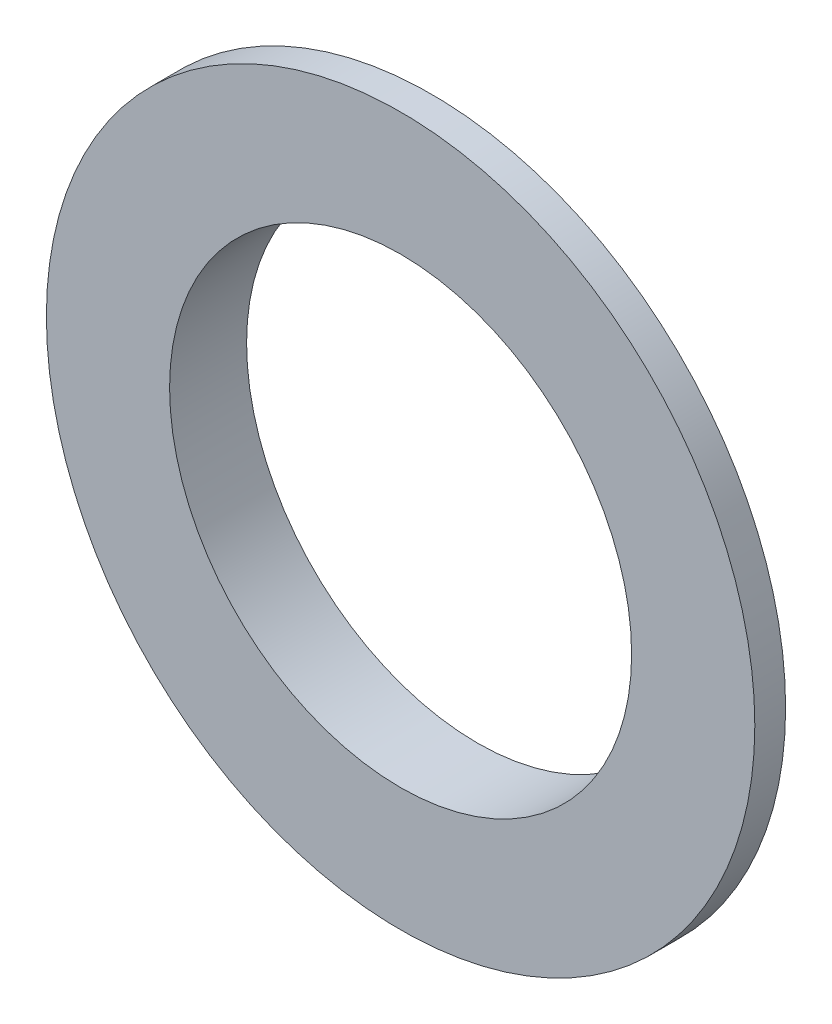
SolidWorks part; units mm, degrees
ref_plane "Plan de face" through (0, 0, 0) normal (0, 0, 1) x (1, 0, 0)
ref_plane "Plan de dessus" through (0, 0, 0) normal (0, 1, 0) x (1, 0, 0)
ref_plane "Plan de droite" through (0, 0, 0) normal (1, 0, 0) x (0, 0, -1)
sketch "Esquisse1" plane through (0, 0, 0) normal (1, 0, 0) x (0, 0, -1)
  line L0 (0, 0) -> (-23.7886, 0) construction
  line L1 (0, 0) -> (0, 8.5)
  line L2 (0, 8.5) -> (-1.5, 8.5)
  line L3 (-1.5, 8.5) -> (-1.5, 11.5)
  line L4 (-1.5, 11.5) -> (-2.5, 11.5)
  line L5 (-2.5, 11.5) -> (-2.5, 0)
  line L6 (-2.5, 0) -> (0, 0)
  dimension "D1" = 8.5
  dimension "D2" = 1.5
  dimension "D3" = 1
  dimension "D4" = 11.5
revolve "Révolution1" add sketch "Esquisse1" angle 360 about L0
sketch "Esquisse2" plane through (0, 0, 2.5) normal (0, 0, 1) x (1, 0, 0)
  circle A0 centre (0, 0) radius 7.5
  dimension "D1" = 15
extrude "Enlèv. mat.-Extru.1" cut sketch "Esquisse2" against normal through all
